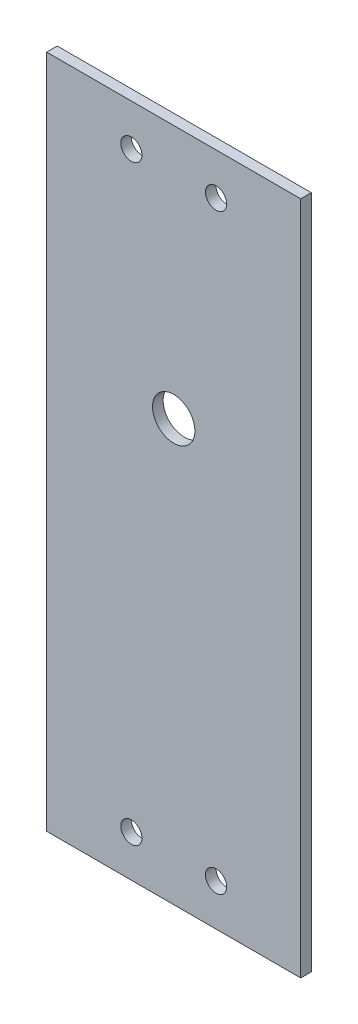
SolidWorks part; units mm, degrees
ref_plane "Front Plane" through (0, 0, 0) normal (0, 0, 1) x (1, 0, 0)
ref_plane "Top Plane" through (0, 0, 0) normal (0, 1, 0) x (1, 0, 0)
ref_plane "Right Plane" through (0, 0, 0) normal (1, 0, 0) x (0, 0, -1)
sketch "Sketch1" plane through (0, 0, 0) normal (0, 0, 1) x (1, 0, 0)
  line L0 (0, 0) -> (0, -202.4)
  line L1 (0, -202.4) -> (76.2, -202.4)
  line L2 (76.2, -202.4) -> (76.2, 0)
  line L3 (76.2, 0) -> (0, 0)
  dimension "D1" = 76.2
  dimension "D2" = 202.4
extrude "Boss-Extrude1" add sketch "Sketch1" along normal blind 3.175
sketch "Sketch2" plane through (0, 0, 3.175) normal (0, 0, 1) x (1, 0, 0)
  line L0 (0, 0) -> (0, -202.4) construction
  line L1 (76.2, -202.4) -> (76.2, 0) construction
  line L2 (76.2, 0) -> (0, 0) construction
  line L3 (0, -101.2) -> (76.2, -101.2) construction
  circle A0 centre (25.4, -12.5) radius 3.175
  circle A1 centre (50.8, -12.5) radius 3.175
  circle A2 centre (50.8, -189.9) radius 3.175
  circle A3 centre (25.4, -189.9) radius 3.175
  circle A4 centre (38.1, -76.2) radius 6.35
  point P18 (38.1, -101.2)
  dimension "D1" = 6.35
  dimension "D2" = 6.35
  dimension "D7" = 12.7
  dimension "D3" = 25.4
  dimension "D4" = 25.4
  dimension "D5" = 12.5
  dimension "D6" = 12.5
  dimension "D8" = 76.2
extrude "Cut-Extrude1" cut sketch "Sketch2" against normal up to surface (3.175 mm away)
